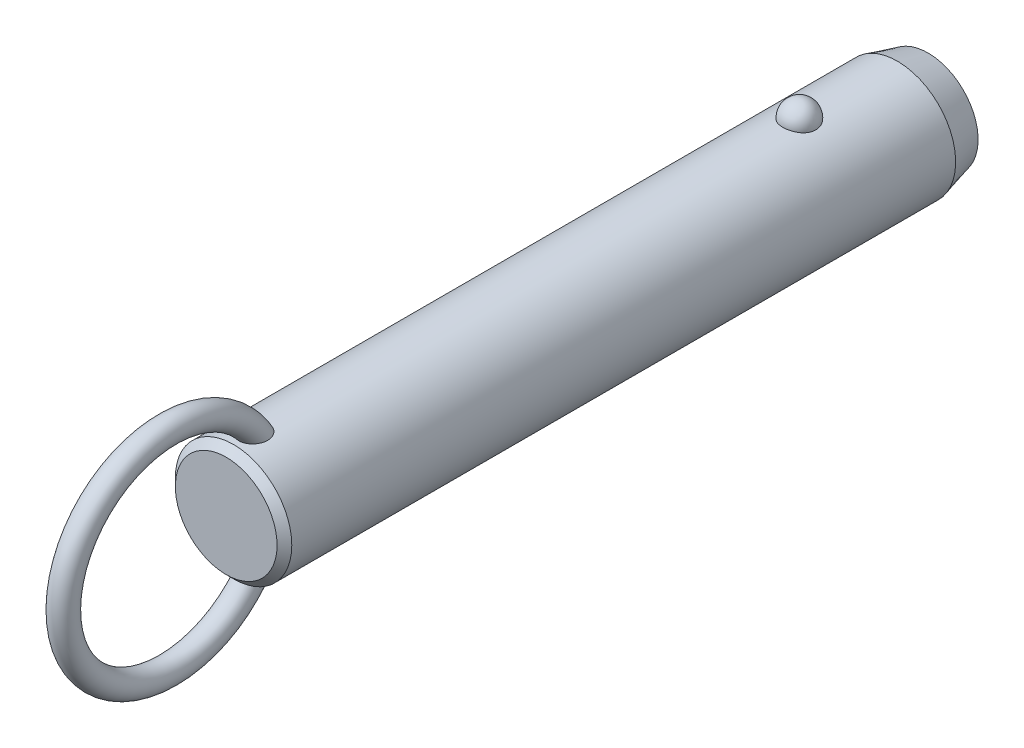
SolidWorks part; units mm, degrees
ref_plane "Front Plane" through (0, 0, 0) normal (0, 0, 1) x (1, 0, 0)
ref_plane "Top Plane" through (0, 0, 0) normal (0, 1, 0) x (1, 0, 0)
ref_plane "Right Plane" through (0, 0, 0) normal (1, 0, 0) x (0, 0, -1)
sketch "Sketch2" plane through (0, 0, 0) normal (0, 0, 1) x (1, 0, 0)
  circle A0 centre (0, 0) radius 9.5
  point P3 (0, 9.5)
  dimension "D1" = 19
extrude "Boss-Extrude1" add sketch "Sketch2" along normal blind 81.3
sketch "Sketch3" plane through (0, 0, 0) normal (0, 0, -1) x (-1, 0, 0)
  circle A0 centre (0, 0) radius 9.5
  dimension "D1" = 19
extrude "Boss-Extrude2" add sketch "Sketch3" along normal blind 23.7
chamfer "Chamfer1" distance 5 angle 15 1 edges at (-9.5, 0, -23.7)
sketch "Sketch12" plane through (0, 0, 0) normal (1, 0, 0) x (0, 0, -1)
  line L0 (-81.3, 9.5) -> (-81.3, -9.5) construction
  point P0 (-81.3, 0)
sketch "Sketch13" plane through (0, 0, 0) normal (1, 0, 0) x (0, 0, -1)
  circle A0 centre (-100.35, 0) radius 19.05
  point P2 (-81.3, 0)
  dimension "D1" = 38.1
sketch "Sketch14" plane through (0, 0, 0) normal (0, 1, 0) x (1, 0, 0)
  circle A0 centre (0, -83.3) radius 2
  point P2 (0, -81.3)
  dimension "D1" = 4
sweep "Sweep1" add profiles "Sketch14" path "Sketch13"
sketch "Sketch15" plane through (0, 0, 81.3) normal (0, 0, 1) x (1, 0, 0)
  circle A0 centre (0, 0) radius 9.5
  dimension "D1" = 19
extrude "Boss-Extrude3" add sketch "Sketch15" along normal blind 9.52
chamfer "Chamfer2" distance 1.2 angle 45 1 edges at (9.5, 0, 90.82)
sketch "Sketch18" plane through (0, 0, 0) normal (1, 0, 0) x (0, 0, -1)
  line L0 (18.7, 9.5) -> (-83.8378, 9.5) construction
  line L1 (2.7, 12.2) -> (2.7, 6.8)
  line L2 (-83.8378, -9.5) -> (18.7, -9.5) construction
  arc A0 (2.7, 12.2) -> (2.7, 6.8) centre (2.7, 9.5) ccw
  point P4 (0, 9.5)
  dimension "D1" = 21.7
revolve "Revolve1" add sketch "Sketch18" angle 360 about L1
